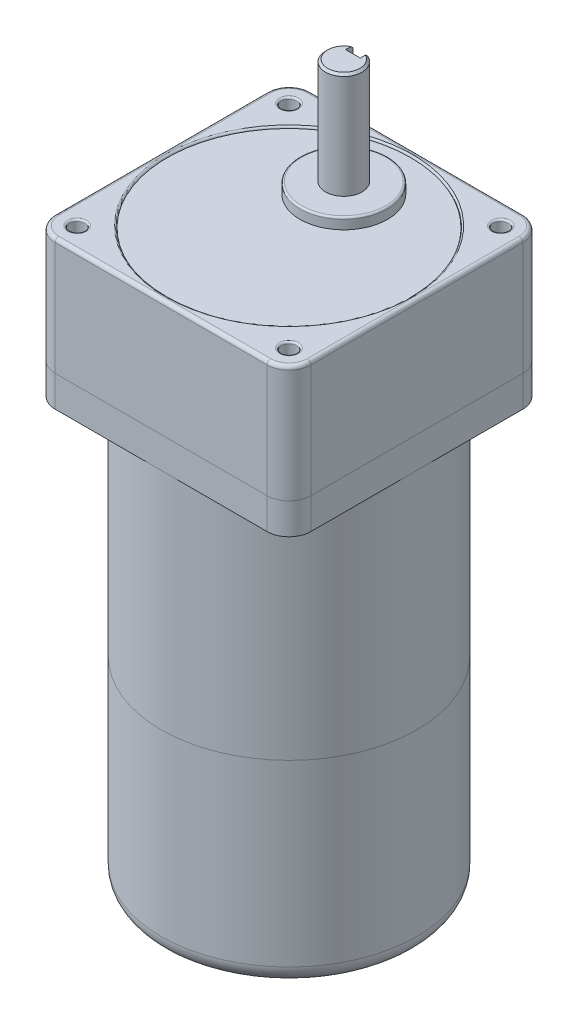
SolidWorks part; units mm, degrees
ref_plane "前视基准面" through (0, 0, 0) normal (0, 0, 1) x (1, 0, 0)
ref_plane "上视基准面" through (0, 0, 0) normal (0, 1, 0) x (1, 0, 0)
ref_plane "右视基准面" through (0, 0, 0) normal (1, 0, 0) x (0, 0, -1)
sketch "草图1" plane through (0, 0, 0) normal (0, 1, 0) x (1, 0, 0)
  line L1 (29, -35) -> (-29, -35)
  line L2 (35, -29) -> (35, 29)
  line L3 (29, 35) -> (-29, 35)
  line L4 (-35, -29) -> (-35, 29)
  line L5 (35, -35) -> (-35, 35) construction
  line L6 (35, 35) -> (-35, -35) construction
  arc A0 (-29, 35) -> (-35, 29) centre (-29, 29) ccw
  arc A1 (-29, -35) -> (-35, -29) centre (-29, -29) cw
  arc A2 (29, -35) -> (35, -29) centre (29, -29) ccw
  arc A3 (35, 29) -> (29, 35) centre (29, 29) ccw
  point P0 (0, 0)
  dimension "D1" = 6
extrude "凸台-拉伸1" add sketch "草图1" against normal blind 32
sketch "草图2" plane through (0, -32, 0) normal (0, -1, 0) x (1, 0, 0)
  line L0 (-29, 35) -> (29, 35) construction
  line L1 (-29, -35) -> (29, -35)
  line L2 (-35, -29) -> (-35, 29)
  line L3 (-29, 35) -> (29, 35)
  line L4 (35, -29) -> (35, 29)
  line L5 (-35, -35) -> (35, 35) construction
  line L6 (-35, 35) -> (35, -35) construction
  arc A0 (-29, -35) -> (-35, -29) centre (-29, -29) cw
  arc A1 (29, -35) -> (35, -29) centre (29, -29) ccw
  arc A2 (29, 35) -> (35, 29) centre (29, 29) cw
  arc A3 (-35, 29) -> (-29, 35) centre (-29, 29) cw
  point P0 (0, 0)
  dimension "D1" = 6
extrude "凸台-拉伸2" add sketch "草图2" along normal blind 8.5 separate body
sketch "草图3" plane through (0, -40.5, 0) normal (0, -1, 0) x (-1, 0, 0)
  circle A0 centre (0, 0) radius 35
extrude "凸台-拉伸3" add sketch "草图3" along normal blind 61.5 separate body
sketch "草图4" plane through (0, -102, 0) normal (0, -1, 0) x (1, 0, 0)
  circle A0 centre (0, 0) radius 35
extrude "凸台-拉伸4" add sketch "草图4" along normal blind 54 separate body
fillet "圆角1" radius 5 1 edges at (0, -156, -35)
fillet "圆角2" radius 1 8 edges at (0, 0, -35) (33.2426, 0, -33.2426) (35, 0, 0) (33.2426, 0, 33.2426) (0, 0, 35) (-33.2426, 0, 33.2426) (-35, 0, 0) (-33.2426, 0, -33.2426)
sketch "草图5" plane through (0, 0, 0) normal (0, 1, 0) x (1, 0, 0)
  circle A0 centre (0, 15) radius 12
extrude "凸台-拉伸5" add sketch "草图5" along normal blind 3 separate body
fillet "圆角3" radius 0.5 1 edges at (0, 3, -3)
sketch "草图6" plane through (0, 3, 0) normal (0, 1, 0) x (1, 0, 0)
  circle A0 centre (0, 15) radius 5
extrude "凸台-拉伸6" add sketch "草图6" along normal blind 29 separate body
sketch "草图7" plane through (0, 0, 0) normal (0, 1, 0) x (1, 0, 0)
  circle A0 centre (0, 0) radius 33.3
extrude "切除-拉伸1" cut sketch "草图7" against normal blind 0.5
fillet "圆角4" radius 0.5 1 edges at (0, 0, 33.3)
ref_plane "基准面1" through (0, 0, -20) normal (0, 0, 1) x (1, 0, 0)
sketch "草图9" plane through (0, 0, -20) normal (0, 0, 1) x (1, 0, 0)
  line L1 (5, 32) -> (-5, 32) construction
  line L2 (-2, 9) -> (-2, 32)
  line L3 (-2, 32) -> (2, 32)
  line L4 (2, 32) -> (2, 9)
  arc A0 (-2, 9) -> (2, 9) centre (0, 9) ccw
extrude "切除-拉伸2" cut sketch "草图9" along normal blind 2.5
chamfer "倒角1" distance 0.6 angle 45 1 edges at (0, 32, -10)
sketch "草图10" plane through (0, 0, 0) normal (0, 1, 0) x (1, 0, 0)
  point P19 (-28.9914, -28.9914)
  point P20 (-28.9914, 28.9914)
  point P21 (28.9914, 28.9914)
  point P22 (28.9914, -28.9914)
hole_wizard "M5 螺纹孔1" positions "3D草图1" profile "草图11" tap size "M5" standard "GB"
sketch3d "3D草图1"
  point P0 (-28.9914, 0, -28.9914)
  point P3 (28.9914, 0, -28.9914)
  point P6 (28.9914, 0, 28.9914)
  point P9 (-28.9914, 0, 28.9914)
sketch "草图11" plane through (-28.9914, 0, -28.9914) normal (1, 0, 0) x (0, 0, 1)
  line L0 (0, 0) -> (0, 15.2618)
  line L1 (0, 15.2618) -> (2.1, 14)
  line L2 (2.1, 14) -> (2.1, 0)
  line L5 (2.1, 0) -> (0, 0)
  line L10 (0, 15.2618) -> (-2.1, 14) construction
  line L11 (0, -6.35) -> (0, 107.95) construction
  dimension "螺纹孔钻头直径" = 4.2
  dimension "螺纹孔钻头深度" = 14
  dimension "导头角度" = 118
fillet "圆角5" radius 0.5 4 edges at (-28.9914, 0, 31.0914) (28.9914, 0, 31.0914) (28.9914, 0, -26.8914) (-28.9914, 0, -26.8914)
sketch "草图12" plane through (0, -40.5, 0) normal (0, -1, 0) x (-1, 0, 0)
  circle A5 centre (28.9914, -28.9914) radius 3
  circle A6 centre (-28.9914, -28.9914) radius 3
  circle A7 centre (-28.9914, 28.9914) radius 3
  circle A8 centre (28.9914, 28.9914) radius 3
extrude "切除-拉伸3" cut sketch "草图12" against normal blind 26.5
